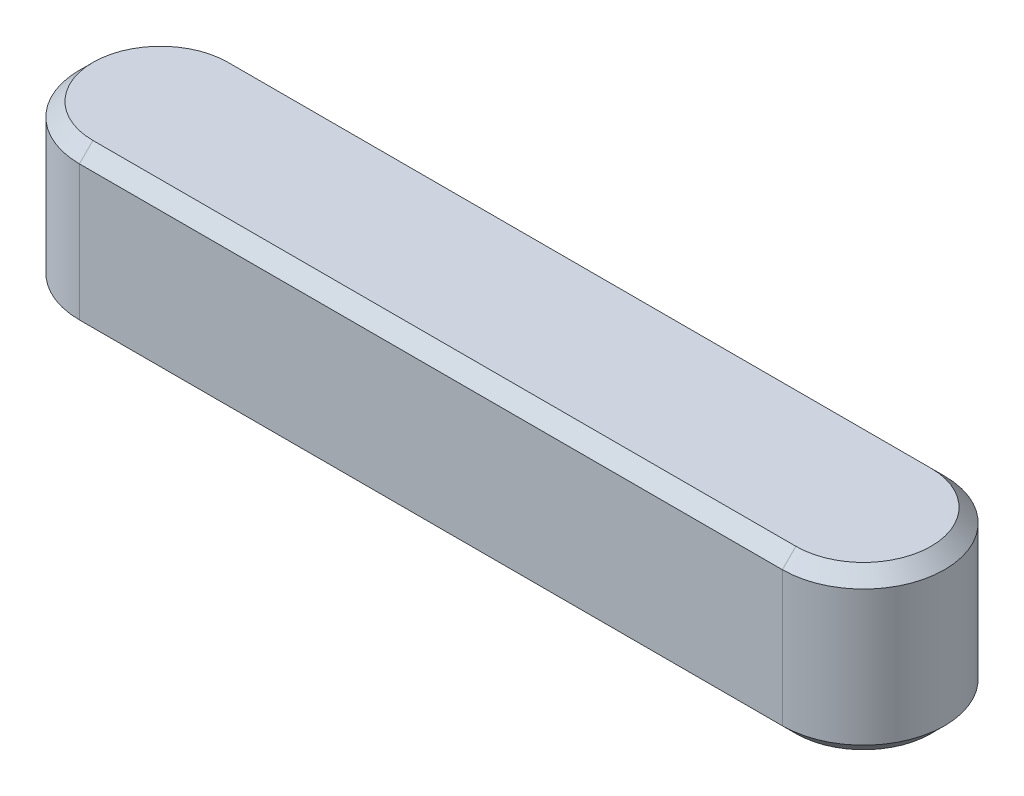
SolidWorks part; units mm, degrees
ref_plane "frontal" through (0, 0, 0) normal (0, 0, 1) x (1, 0, 0)
ref_plane "horizontal" through (0, 0, 0) normal (0, 1, 0) x (1, 0, 0)
ref_plane "profil" through (0, 0, 0) normal (1, 0, 0) x (0, 0, -1)
sketch "Esquisse1" plane through (0, 0, 0) normal (0, 1, 0) x (1, 0, 0)
  line L0 (0, -4) -> (0, 6) construction
  line L1 (-9, 0) -> (9, 0) construction
  line L2 (-13, 3) -> (13, 3)
  line L3 (-13, -3) -> (13, -3)
  arc A0 (13, 3) -> (13, -3) centre (13, 0) cw
  arc A1 (-13, 3) -> (-13, -3) centre (-13, 0) ccw
  point P9 (0, 3)
  point P13 (0, -3)
  dimension "D1" = 26
  dimension "D2" = 3
extrude "Base-Extrusion" add sketch "Esquisse1" along normal blind 6
chamfer "Chanfrein1-0.5" distance 0.5 angle 45
